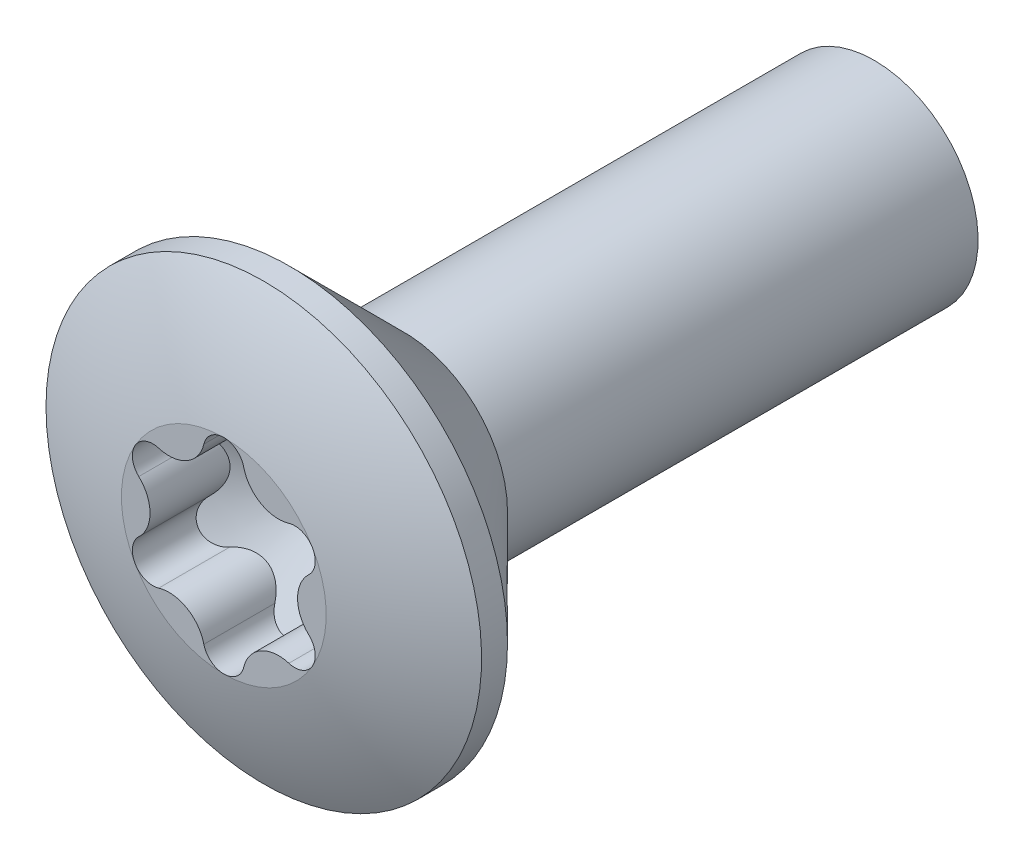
SolidWorks part; units mm, degrees
ref_plane "Front Plane" through (0, 0, 0) normal (0, 0, 1) x (1, 0, 0)
ref_plane "Top Plane" through (0, 0, 0) normal (0, 1, 0) x (1, 0, 0)
ref_plane "Right Plane" through (0, 0, 0) normal (1, 0, 0) x (0, 0, -1)
sketch "BodySke"
revolve "Base-Revolve" add sketch "BodySke" angle 360 about L0
sketch "PreBSke"
revolve "PreBroach" cut sketch "PreBSke" angle 360 about L0
ref_plane "Plane1" through (0, 0, -0.2076) normal (0, 0, 1) x (1, 0, 0)
sketch "HexSke"
extrude "Hexalobular" add sketch "HexSke" against normal up to next
sketch "ThdSchSke"
revolve "ThreadSchematic" cut sketch "ThdSchSke" angle 360 about L6
ref_plane "ThreadPlane" through (0, 0, -3.6788) normal (0, 0, -1) x (-1, 0, 0)
pattern_linear "ThdSchPat" [suppressed] count 12
equation "\"Ri@HexSke\"= .1 * \"A@PreBSke\""
equation "\"Re@HexSke\"= .175 * \"A@PreBSke\""
equation "\"MinorDia@ThreadCosmetic\"= \"MinorDia@ThdSchSke\""
equation "\"ThreadLength\"= IIF ( \"B@BodySke\" = \"L@BodySke\" , \"L@BodySke\" - \"K@BodySke\" , \"B@BodySke\" )"
equation "\"ThdLen@ThreadPlane\"=\"ThreadLength\""
equation "\"ThdLen@ThreadCosmetic\"=\"ThreadLength\""
